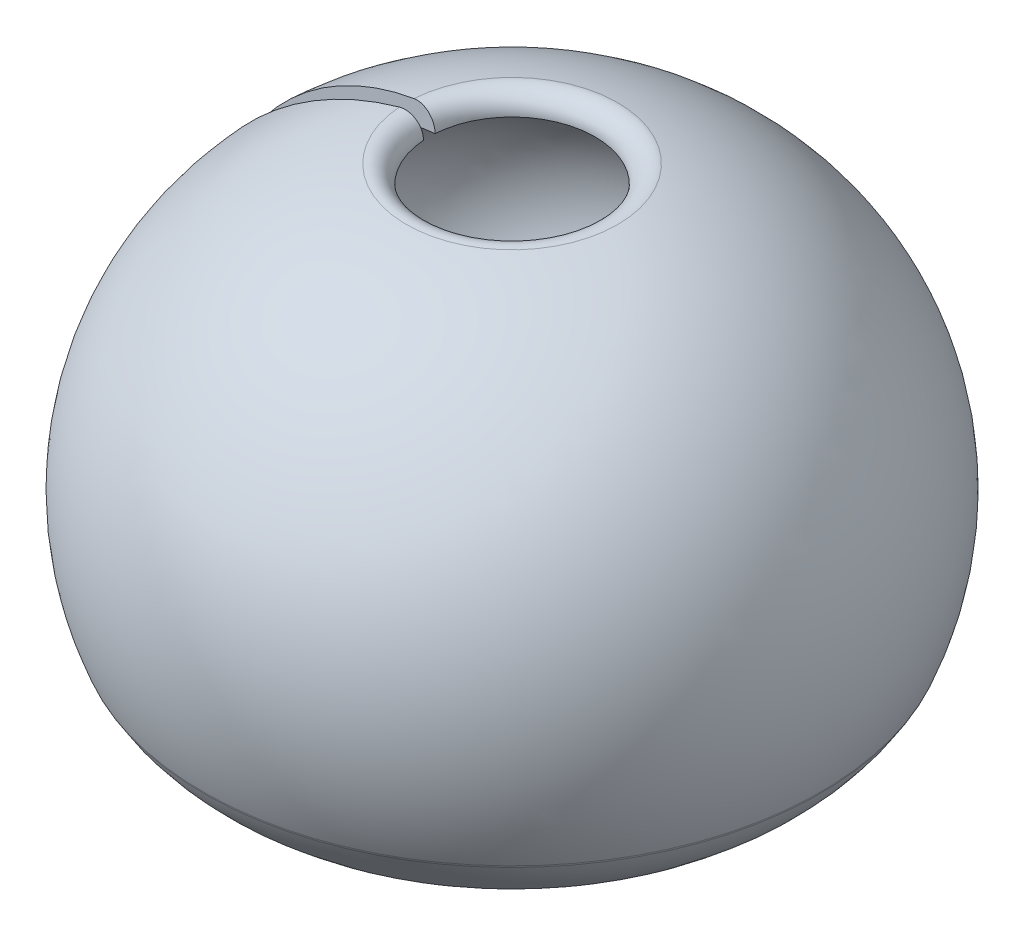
SolidWorks part; units mm, degrees
ref_plane "Ebene vorne" through (0, 0, 0) normal (0, 0, 1) x (1, 0, 0)
ref_plane "Ebene oben" through (0, 0, 0) normal (0, 1, 0) x (1, 0, 0)
ref_plane "Ebene rechts" through (0, 0, 0) normal (1, 0, 0) x (0, 0, -1)
sketch "H1000_Kinematik" plane through (0, 0, 0) normal (0, 0, -1) x (-1, 0, 0)
  line L0 (0, 0) -> (-125.05, 385)
  line L1 (-125.05, 385) -> (-125.05, 791.9296)
  line L2 (-125.05, 791.9296) -> (-125.05, 848.9296) construction
  line L3 (-125.05, 848.9296) -> (-557.75, 848.9296)
  line L4 (-557.75, 848.9296) -> (-614.75, 848.9296)
sketch "Arbeitsraum_Konstruktionsskizze" plane through (0, 0, 0) normal (0, 0, 1) x (1, 0, 0)
  line L1 (160.5163, 790.3811) -> (210.8443, 817.141) construction
  line L2 (313.3286, 1199.1924) -> (340.0885, 1249.5205) construction
  line L3 (413.9846, 435.0896) -> (445.029, 482.8938) construction
  line L4 (210.8443, 817.141) -> (413.9846, 435.0896) construction
  line L5 (557.75, 848.9296) -> (614.75, 848.9296) construction
  line L6 (125.05, 385) -> (519.8921, 286.5548) construction
  line L7 (356.9933, 436.0844) -> (413.9846, 435.0896) construction
  line L8 (256.3373, 1198.1977) -> (313.3286, 1199.1924) construction
  line L9 (313.3286, 1199.1924) -> (344.373, 1151.3882) construction
  line L12 (519.8921, 286.5548) -> (554.1955, 332.077) construction
  line L14 (554.1955, 332.077) -> (899.7651, 71.6717) construction
  line L16 (899.7651, 71.6717) -> (945.2873, 37.3682) construction
  line L17 (125.05, 385) -> (125.05, 791.9296) construction
  line L18 (519.8921, 286.5548) -> (538.4495, 232.6603) construction
  line L19 (445.029, 482.8938) -> (440.7445, 384.7616) construction
  line L20 (110.1882, 817.141) -> (125.05, 385) construction
  line L21 (160.5163, 790.3811) -> (125.05, 385) construction
  line L22 (125.05, 385) -> (554.1955, 332.077) construction
  line L23 (340.0885, 1249.5205) -> (256.3373, 1198.1977) construction
  line L24 (538.4495, 232.6603) -> (129.3236, 91.7869) construction
  line L25 (160.5163, 790.3811) -> (110.1882, 817.141) construction
  line L26 (110.1882, 817.141) -> (313.3286, 1199.1924) construction
  line L27 (125.05, 791.9296) -> (125.05, 848.9296) construction
  line L28 (125.05, 848.9296) -> (557.75, 848.9296) construction
  line L29 (413.9846, 435.0896) -> (440.7445, 384.7616) construction
  line L30 (129.3236, 91.7869) -> (75.429, 73.2295) construction
  line L31 (907.698, 128.117) -> (899.7651, 71.6717) construction
  line L32 (899.7651, 71.6717) -> (847.693, 48.4877) construction
  line L33 (907.698, 128.117) -> (945.2873, 37.3682) construction
  line L34 (139.2215, 147.921) -> (129.3236, 91.7869) construction
  line L35 (129.3236, 91.7869) -> (171.6828, 53.6465) construction
  line L36 (171.6828, 53.6465) -> (75.429, 73.2295) construction
  line L37 (0, 0) -> (0, 642.4236) construction
  line L38 (125.05, 385) -> (210.8443, 817.141) construction
  line L39 (125.05, 385) -> (538.4495, 232.6603) construction
  line L40 (125.05, 385) -> (125.05, 791.9296) construction
  arc A26 (952.6069, 50.3002) -> (326.1707, 1254.7269) centre (125.05, 385) ccw
  arc A29 (139.2215, 147.921) -> (356.9933, 436.0844) centre (125.05, 385) ccw
  arc A30 (78.3143, 66.3497) -> (949.3776, 43.6074) centre (519.8921, 286.5548) ccw
  circle A34 centre (313.3286, 1199.1924) radius 57 construction
  circle A36 centre (413.9846, 435.0896) radius 57 construction
  arc A38 (326.1707, 1254.7269) -> (256.3373, 1198.1977) centre (313.3286, 1199.1924) ccw
  circle A39 centre (899.7651, 71.6717) radius 57 construction
  circle A40 centre (129.3236, 91.7869) radius 57 construction
  arc A41 (344.373, 1151.3882) -> (356.9933, 436.0844) centre (160.5163, 790.3811) cw
  arc A43 (364.0974, 1173.2786) -> (344.373, 1151.3882) centre (313.3286, 1199.1924) cw
  arc A44 (78.3143, 66.3497) -> (139.2215, 147.921) centre (129.3236, 91.7869) cw
  arc A45 (949.3776, 43.6074) -> (952.6069, 50.3002) centre (899.7651, 71.6717) ccw
  arc A46 (256.3373, 1198.1977) -> (364.0974, 1173.2786) centre (125.05, 385) cw
  point P0 (125.05, 385)
  point P1 (160.5163, 790.3811)
  dimension "D3" = 57
  dimension "D6" = 119
  dimension "D1" = 67
  dimension "D4" = 1017.7283
  dimension "D5" = 5
  dimension "D2" = 104
revolve "Rotation1" add sketch "Arbeitsraum_Konstruktionsskizze" angle 176 about L37
inserted part "P005125"
sketch "Arbeitsraum_Flaeche_H900" plane through (0, 0, 0) normal (0, 0, 1) x (1, 0, 0)
  line L0 (-333.6997, 692.4881) -> (527.6336, 692.4881) construction
  line L1 (0, 1274.8249) -> (0, 1173.8496)
  line L2 (0, -200000) -> (0, 200642.4236) construction
  arc A0 (0, 1173.8496) -> (277.6116, 588.5607) centre (-70.6358, 781.8637) cw
  arc A1 (0, 1274.8249) -> (907.8431, 336.9784) centre (26.6749, 392.3233) cw
  arc A2 (907.8431, 336.9784) -> (217.1698, 4.0345) centre (417.2554, 471.8215) cw
  arc A3 (277.6116, 588.5607) -> (197.3822, 108.2982) centre (46.9252, 380.2651) cw
  arc A4 (217.1698, 4.0345) -> (197.3822, 108.2982) centre (242.3121, 62.8157) cw
revolve "Rotation2" [suppressed] add sketch "Arbeitsraum_Flaeche_H900" angle 352 mid plane about L37
equation "\"P0\" = 0"
equation "\"P1X\" = 125.05"
equation "\"P1Y\" = 385"
equation "\"P2X\" = 194.803639"
equation "\"P2Y\" = 357.391967"
equation "\"P3X\" = 72.231829"
equation "\"P3Y\" = 432.092466"
equation "\"P6X\" = 16.422696"
equation "\"P6Y\" = 299.701239"
equation "\"P8X\" = 114.1808843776"
equation "\"P8Y\" = 494.8100144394"
equation "\"P10X\" = -62.453182"
equation "\"P10Y\" = 788.641472"
equation "\"P11X\" = 125.05"
equation "\"P11Y\" = 791.92963"
equation "\"dist_2_4\" = 142.772177"
equation "\"dist_1_7\" = 102.870927"
equation "\"dist_3_5\" = 215.183472"
equation "\"dist_4_5\" = 204.786981"
equation "\"dist_5_6\" = 227.782995"
equation "\"dist_1_11\" = 406.92963"
equation "\"dist_1_17\" = 0.0"
equation "\"dist_6_17\" = 0.0"
equation "\"dist_6_8\" = 218.229461"
equation "\"dist_8_11\" = 297.318354"
equation "\"dist_7_9\" = 197.670964"
equation "\"dist_8_9\" = 190.191027"
equation "\"dist_9_16\" = 0.0"
equation "\"dist_16_17\" = 0.0"
equation "\"dist_11_18\" = 57"
equation "\"dist_12_18\" = 126.1"
equation "\"dist_13_18\" = 432.70000000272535"
equation "\"dist_13_14\" = 57.0"
equation "\"dist_10_16\" = 0.0"
equation "\"dist_9_10\" = 286.776102"
equation "\"D6@H1000_Kinematik\" = \"P1Y\""
equation "\"D4@H1000_Kinematik\" = \"dist_1_11\""
equation "\"D1@H1000_Kinematik\" = \"dist_11_18\""
equation "\"D2@H1000_Kinematik\" = \"dist_13_18\""
equation "\"D3@H1000_Kinematik\" = \"dist_13_14\""
equation "\"D5@H1000_Kinematik\" = \"P1X\""
